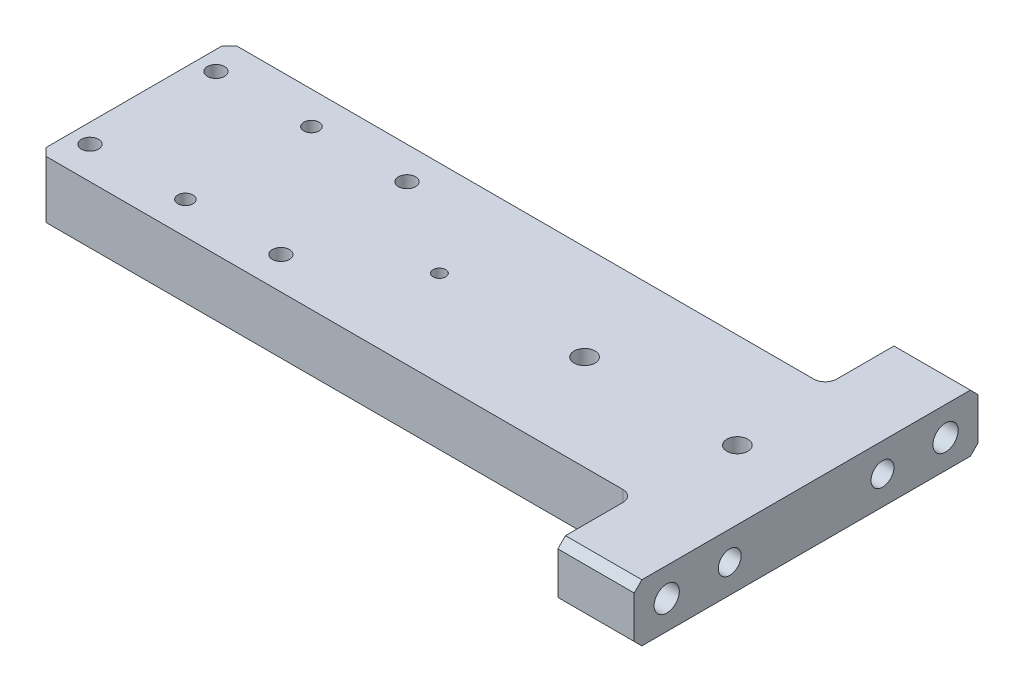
SolidWorks part; units mm, degrees
ref_plane "前视基准面" through (0, 0, 0) normal (0, 0, 1) x (1, 0, 0)
ref_plane "上视基准面" through (0, 0, 0) normal (0, 1, 0) x (1, 0, 0)
ref_plane "右视基准面" through (0, 0, 0) normal (1, 0, 0) x (0, 0, -1)
sketch "草图1" plane through (0, 0, 0) normal (0, 1, 0) x (1, 0, 0)
  line L1 (-88, 45) -> (88, 45)
  line L2 (-88, 45) -> (-88, -45)
  line L3 (-88, -45) -> (88, -45)
  line L4 (88, 45) -> (88, -45)
  line L5 (-88, 45) -> (88, -45) construction
  line L6 (-88, -45) -> (88, 45) construction
  point P0 (0, 0)
  dimension "D1" = 176
  dimension "D2" = 90
extrude "凸台-拉伸1" add sketch "草图1" along normal blind 15
hole_wizard "M4 六角圆柱头螺钉的柱形沉头孔1" positions "草图13" profile "草图14" counterbore size "M4" standard "GB"
sketch "草图13" plane through (0, 0, 0) normal (0, -1, 0) x (-1, 0, 0)
  line L1 (33, 16.5) -> (83, 16.5) construction
  line L2 (33, 16.5) -> (33, -16.5) construction
  line L3 (33, -16.5) -> (83, -16.5) construction
  line L4 (83, 16.5) -> (83, -16.5) construction
  line L5 (83, 0) -> (88, 0) construction
  line L6 (88, 45) -> (88, -45) construction
  point P0 (83, 16.5)
  point P3 (83, -16.5)
  point P6 (33, 16.5)
  point P9 (33, -16.5)
  dimension "D1" = 50
  dimension "D2" = 33
  dimension "D3" = 5
sketch "草图14" plane through (-83, 0, -16.5) normal (1, 0, 0) x (0, 0, -1)
  line L0 (0, 0) -> (0, 15)
  line L1 (0, 15) -> (2.25, 15)
  line L3 (2.25, 15) -> (2.25, 4.6)
  line L4 (2.25, 4.6) -> (4, 4.6)
  line L5 (4, 4.6) -> (4, 0)
  line L7 (4, 0) -> (0, 0)
  line L11 (0, -6.35) -> (0, 107.95) construction
  dimension "通孔孔直径" = 4.5
  dimension "通孔孔深度" = 15
  dimension "柱形沉头孔直径" = 8
  dimension "柱形沉头孔深度" = 4.6
hole_wizard "Ø4.0mm 暗销孔1" positions "草图17" profile "草图18" hole size "Ø4.0" standard "ISO"
sketch "草图17" plane through (0, 15, 0) normal (0, 1, 0) x (1, 0, 0)
  line L5 (-83, -16.5) -> (-33, -16.5) construction
  line L7 (-83, 16.5) -> (-33, 16.5) construction
  point P0 (-58, -16.5)
  point P3 (-58, 16.5)
sketch "草图18" plane through (-58, 15, 16.5) normal (1, 0, 0) x (0, 0, 1)
  line L0 (0, 0) -> (0, 5)
  line L1 (0, 5) -> (2, 5)
  line L2 (2, 5) -> (2, 0)
  line L5 (2, 0) -> (0, 0)
  line L10 (0, 5) -> (-2, 5) construction
  line L11 (0, -6.35) -> (0, 107.95) construction
  dimension "孔直径" = 4
  dimension "孔深度" = 5
  dimension "导头角度" = 180
hole_wizard "M4 螺纹孔3" positions "草图39" profile "草图40" tap size "M4" standard "GB"
sketch "草图39" plane through (0, 15, 0) normal (0, 1, 0) x (1, 0, 0)
  line L0 (0, 0) -> (-50000, 0) construction
  line L3 (-88, 45) -> (-88, -45) construction
  point P10 (-8, 0)
  dimension "D1" = 80
sketch "草图40" plane through (-8, 15, 0) normal (1, 0, 0) x (0, 0, 1)
  line L0 (0, 0) -> (0, 15)
  line L1 (0, 15) -> (1.65, 15)
  line L2 (1.65, 15) -> (1.65, 0)
  line L5 (1.65, 0) -> (0, 0)
  line L11 (0, -6.35) -> (0, 107.95) construction
  dimension "通孔螺纹孔钻头直径" = 3.3
  dimension "通孔螺纹孔钻头深度" = 15
sketch "草图49" plane through (0, 15, 0) normal (0, 1, 0) x (1, 0, 0)
  line L0 (-88, 0) -> (66.5972, 0) construction
  line L1 (-144.979, -65.6184) -> (68, -65.6184)
  line L2 (-144.979, -65.6184) -> (-144.979, -25)
  line L3 (-144.979, -25) -> (68, -25)
  line L4 (68, -65.6184) -> (68, -25)
  line L5 (-144.979, 88.7615) -> (68, 88.7615)
  line L6 (-144.979, 88.7615) -> (-144.979, 25)
  line L7 (-144.979, 25) -> (68, 25)
  line L8 (68, 88.7615) -> (68, 25)
  line L9 (-88, 45) -> (-88, -45) construction
  line L10 (88, -45) -> (88, 45) construction
  dimension "D1" = 50
  dimension "D2" = 20
extrude "切除-拉伸3" cut sketch "草图49" against normal through all
hole_wizard "M6 间隙孔2" positions "草图52" profile "草图53" hole size "M6" standard "ISO"
sketch "草图52" plane through (68, 0, 0) normal (-1, 0, 0) x (0, 0, 1)
  line L1 (45, 7.5) -> (-45, 7.5) construction
  line L2 (45, 15) -> (45, 0) construction
  line L3 (-45, 0) -> (-45, 15) construction
  line L5 (0, 0) -> (0, 7.5) construction
  point P0 (36.5, 7.5)
  point P2 (-36.5, 7.5)
  dimension "D1" = 8.5
sketch "草图53" plane through (68, 7.5, 36.5) normal (0, 1, 0) x (0, 0, 1)
  line L0 (0, 0) -> (0, 20)
  line L1 (0, 20) -> (3.3, 20)
  line L2 (3.3, 20) -> (3.3, 0)
  line L5 (3.3, 0) -> (0, 0)
  line L11 (0, -6.35) -> (0, 107.95) construction
  dimension "通孔孔直径" = 6.6
  dimension "通孔孔深度" = 20
hole_wizard "Ø6.0mm 暗销孔1" positions "草图57" profile "草图58" hole size "Ø6.0" standard "GB"
sketch "草图57" plane through (88, 0, 0) normal (1, 0, 0) x (0, 0, -1)
  line L1 (0, 15) -> (0, 0) construction
  line L2 (-45, 15) -> (45, 15) construction
  line L3 (-45, 0) -> (45, 0) construction
  line L7 (-20, 7.5) -> (-45, 7.5) construction
  line L8 (-45, 15) -> (-45, 0) construction
  point P0 (-20, 7.5)
  point P2 (20, 7.5)
  dimension "D1" = 40
sketch "草图58" plane through (88, 7.5, 20) normal (0, 1, 0) x (0, 0, -1)
  line L0 (0, 0) -> (0, 5)
  line L1 (0, 5) -> (3, 5)
  line L2 (3, 5) -> (3, 0)
  line L5 (3, 0) -> (0, 0)
  line L10 (0, 5) -> (-3, 5) construction
  line L11 (0, -6.35) -> (0, 107.95) construction
  dimension "孔直径" = 6
  dimension "孔深度" = 5
  dimension "导头角度" = 180
hole_wizard "M4 螺纹孔4" positions "草图60" profile "草图59" tap size "M4" standard "GB"
sketch "草图60" plane through (0, 0, 0) normal (0, -1, 0) x (-1, 0, 0)
  point P1 (30, 6)
  point P2 (45, 6)
  dimension "D1" = 30
  dimension "D2" = 45
  dimension "D3" = 6
sketch "草图59" plane through (-30, 0, -6) normal (1, 0, 0) x (0, 0, -1)
  line L0 (0, 0) -> (0, 8.9914)
  line L1 (0, 8.9914) -> (1.65, 8)
  line L2 (1.65, 8) -> (1.65, 0)
  line L5 (1.65, 0) -> (0, 0)
  line L10 (0, 8.9914) -> (-1.65, 8) construction
  line L11 (0, -6.35) -> (0, 107.95) construction
  dimension "螺纹孔钻头直径" = 3.3
  dimension "螺纹孔钻头深度" = 8
  dimension "导头角度" = 118
hole_wizard "M4 螺纹孔5" positions "草图61" profile "草图62" tap size "M4" standard "GB"
sketch "草图61" plane through (0, 0, -25) normal (0, 0, -1) x (-1, 0, 0)
  line L0 (88, 15) -> (-68, 15) construction
  line L1 (88, 15) -> (88, 0) construction
  point P0 (13, 7.5)
  dimension "D1" = 7.5
  dimension "D2" = 75
sketch "草图62" plane through (-13, 7.5, -25) normal (1, 0, 0) x (0, 1, 0)
  line L0 (0, 0) -> (0, 11.0914)
  line L1 (0, 11.0914) -> (1.65, 10.1)
  line L2 (1.65, 10.1) -> (1.65, 0)
  line L5 (1.65, 0) -> (0, 0)
  line L10 (0, 11.0914) -> (-1.65, 10.1) construction
  line L11 (0, -6.35) -> (0, 107.95) construction
  dimension "螺纹孔钻头直径" = 3.3
  dimension "螺纹孔钻头深度" = 10.1
  dimension "导头角度" = 118
fillet "圆角2" radius 3 2 edges at (68, 7.5, -25) (68, 7.5, 25)
chamfer "倒角4" distance 2 angle 45 6 edges at (-88, 7.5, 25) (-88, 7.5, -25) (78, 0, -45) (78, 0, 45) (78, 15, 45) (78, 15, -45)
hole_wizard "M5 六角凹头螺钉的柱形沉头孔1" positions "草图67" profile "草图68" counterbore size "M5" standard "ISO"
sketch "草图67" plane through (0, 0, 0) normal (0, -1, 0) x (-1, 0, 0)
  line L0 (-88, -43) -> (-88, 43) construction
  point P0 (-70, 0)
  point P3 (-30, 0)
  dimension "D1" = 18
  dimension "D2" = 40
sketch "草图68" plane through (70, 0, 0) normal (1, 0, 0) x (0, 0, -1)
  line L0 (0, 0) -> (0, 15)
  line L1 (0, 15) -> (2.75, 15)
  line L3 (2.75, 15) -> (2.75, 5.4)
  line L4 (2.75, 5.4) -> (5, 5.4)
  line L5 (5, 5.4) -> (5, 0)
  line L7 (5, 0) -> (0, 0)
  line L11 (0, -6.35) -> (0, 107.95) construction
  dimension "通孔孔直径" = 5.5
  dimension "通孔孔深度" = 15
  dimension "柱形沉头孔直径" = 10
  dimension "柱形沉头孔深度" = 5.4
